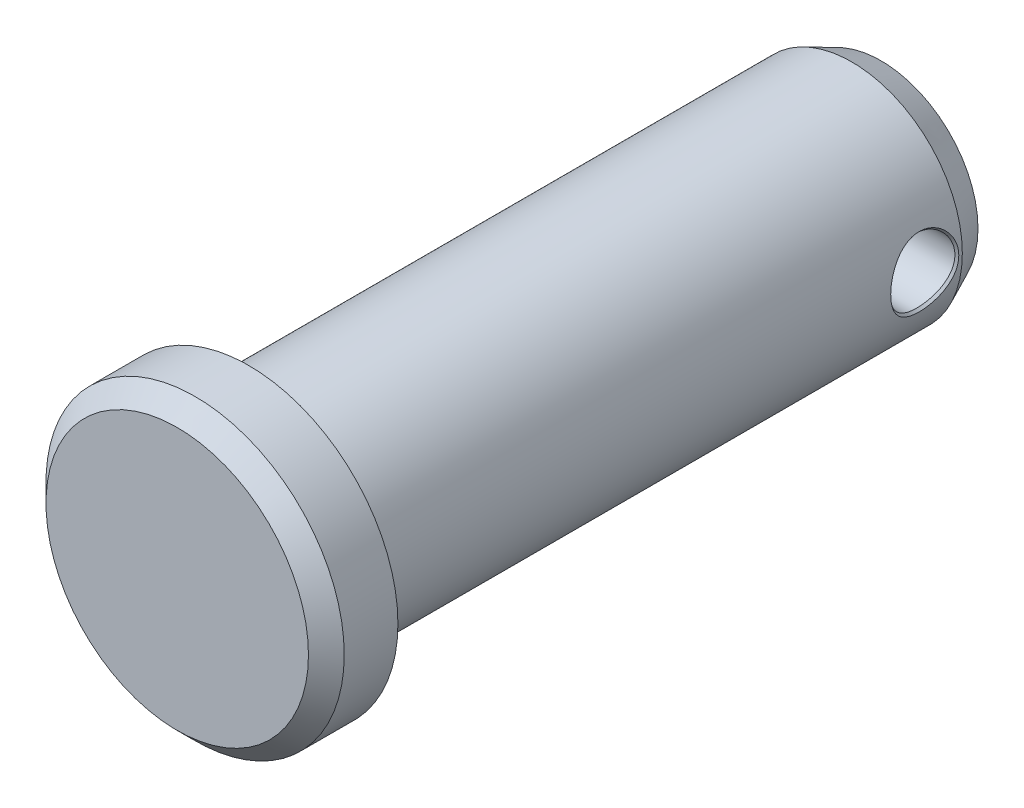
SolidWorks part; units mm, degrees
ref_plane "Front Plane" through (0, 0, 0) normal (0, 0, 1) x (1, 0, 0)
ref_plane "Top Plane" through (0, 0, 0) normal (0, 1, 0) x (1, 0, 0)
ref_plane "Right Plane" through (0, 0, 0) normal (1, 0, 0) x (0, 0, -1)
sketch "Sketch1" plane through (0, 0, 0) normal (1, 0, 0) x (0, 0, -1)
  line L0 (0, 0) -> (0, 5.588)
  line L1 (0, 5.588) -> (0.762, 6.35)
  line L2 (0.762, 6.35) -> (3.048, 6.35)
  line L3 (3.048, 6.35) -> (3.048, 4.9593)
  line L4 (3.302, 4.7053) -> (28.7274, 4.7053)
  line L5 (28.7274, 4.7053) -> (29.972, 4.1275)
  line L6 (29.972, 4.1275) -> (29.972, 0)
  line L7 (29.972, 0) -> (0, 0)
  line L8 (0, 0) -> (190.5, 0) construction
  line L9 (3.048, -4.7054) -> (28.7274, -4.7054) construction
  line L10 (28.7274, -4.7054) -> (29.972, -4.1275) construction
  line L11 (0.762, -6.35) -> (3.048, -6.35) construction
  arc A0 (3.302, 4.7053) -> (3.048, 4.9593) centre (3.302, 4.9593) cw
  point P17 (3.048, 4.7053)
  dimension "Head_fillet_radius" = 0.254
  dimension "Point_ch_dia" = 8.255
  dimension "Shank_dia" = 9.4107
  dimension "Head_dia" = 12.7
  dimension "Head_ht" = 3.048
  dimension "Head_ch_len" = 0.762
  dimension "Head_ch_ang" = 45
  dimension "Length" = 26.924
  dimension "Point_ch_len" = 1.2446
revolve "BaseBody" add sketch "Sketch1" angle 360 about L8
sketch "Sketch2" plane through (0, 0, 0) normal (1, 0, 0) x (0, 0, -1)
  line L0 (3.048, -6.35) -> (3.048, 6.35) construction
  line L1 (0, 0) -> (27.127, 0) construction
  line L2 (0, 5.588) -> (0, -5.588) construction
  circle A0 centre (27.127, 0) radius 1.3845
  dimension "D1" = 2.769
  dimension "D2" = 24.079
extrude "Hole" cut sketch "Sketch2" against normal through all both and the other way through all
chamfer "HoleChamfer1" distance 0.127 angle 45 2 edges at (4.6985, 0.253, -25.7658) (-4.6985, -0.253, -25.7658)
